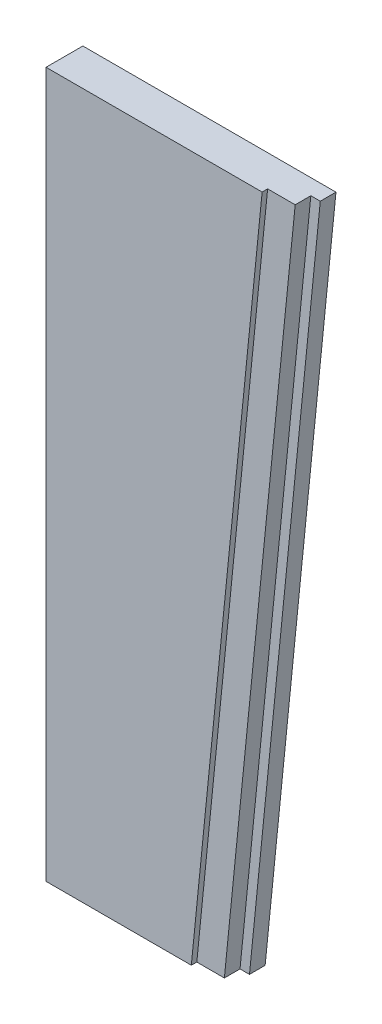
SolidWorks part; units mm, degrees
ref_plane "Спереди" through (0, 0, 0) normal (0, 0, 1) x (1, 0, 0)
ref_plane "Сверху" through (0, 0, 0) normal (0, 1, 0) x (1, 0, 0)
ref_plane "Справа" through (0, 0, 0) normal (1, 0, 0) x (0, 0, -1)
sketch "Эскиз1" plane through (0, 0, 0) normal (0, 0, 1) x (1, 0, 0)
  line L2 (-1786.4608, -900) -> (-1601.0003, -900)
  line L4 (-1510.6033, 0) -> (-1786.4608, 0)
  line L9 (-1786.4608, 0) -> (-1786.4608, -900)
  line L26 (-1510.6033, 0) -> (-1601.0003, -900)
extrude "Вытянуть1" add sketch "Эскиз1" along normal blind 47
sketch "Эскиз2" plane through (0, 0, 0) normal (0, 0, -1) x (-1, 0, 0)
  line L0 (1510.6033, 0) -> (1475.4272, 0)
  line L1 (1601.0003, -900) -> (1565.8242, -900)
  line L2 (1565.8242, -900) -> (1475.4272, 0)
  line L3 (1601.0003, -900) -> (1510.6033, 0) construction
  line L8 (1786.4608, -900) -> (1786.4608, 0)
  line L9 (1786.4608, 0) -> (1510.6033, 0)
  line L10 (1510.6033, 0) -> (1601.0003, -900)
  line L11 (1601.0003, -900) -> (1786.4608, -900)
  line L14 (1510.6033, 0) -> (1601.0003, -900)
  dimension "D1" = 35
  dimension "D2" = 0
extrude "Вытянуть2" add sketch "Эскиз2" against normal blind 40
sketch "Эскиз3" plane through (0, 0, 0) normal (0, 0, -1) x (-1, 0, 0)
  line L0 (1475.4272, 0) -> (1463.3668, 0)
  line L1 (1565.8242, -900) -> (1553.7638, -900)
  line L2 (1553.7638, -900) -> (1463.3668, 0)
  line L3 (1475.4272, 0) -> (1565.8242, -900) construction
  line L8 (1786.4608, -900) -> (1786.4608, 0)
  line L9 (1786.4608, 0) -> (1475.4272, 0)
  line L10 (1475.4272, 0) -> (1565.8242, -900)
  line L11 (1565.8242, -900) -> (1786.4608, -900)
  line L14 (1475.4272, 0) -> (1565.8242, -900)
  dimension "D1" = 12
  dimension "D2" = 0
extrude "Вытянуть3" add sketch "Эскиз3" against normal blind 20
